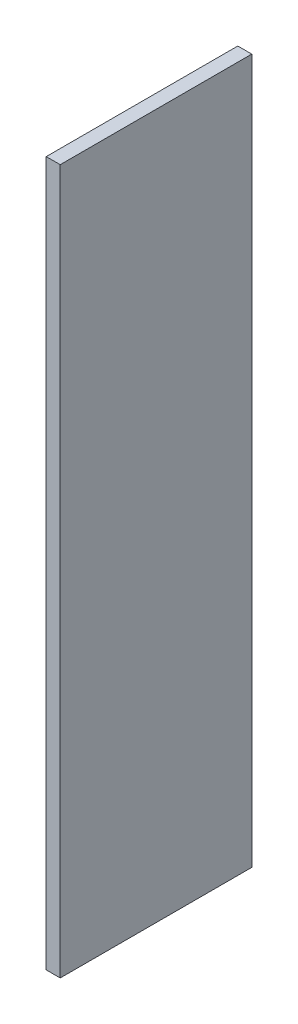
SolidWorks part; units mm, degrees
ref_plane "Front Plane" through (0, 0, 0) normal (0, 0, 1) x (1, 0, 0)
ref_plane "Top Plane" through (0, 0, 0) normal (0, 1, 0) x (1, 0, 0)
ref_plane "Right Plane" through (0, 0, 0) normal (1, 0, 0) x (0, 0, -1)
sketch "Sketch1" plane through (0, 0, 0) normal (0, 0, 1) x (1, 0, 0)
  line L0 (-0.75, -57.5) -> (-109.25, -57.5) construction
  line L1 (-3.75, -57.5) -> (-0.75, -57.5)
  line L2 (-3.75, -57.5) -> (-3.75, 93.6046)
  line L3 (-3.75, 93.6046) -> (-0.75, 93.6046)
  line L4 (-0.75, -57.5) -> (-0.75, 93.6046)
  dimension "D1" = 3
extrude "Boss-Extrude1" add sketch "Sketch1" along normal up to surface (41.0944 mm away)
